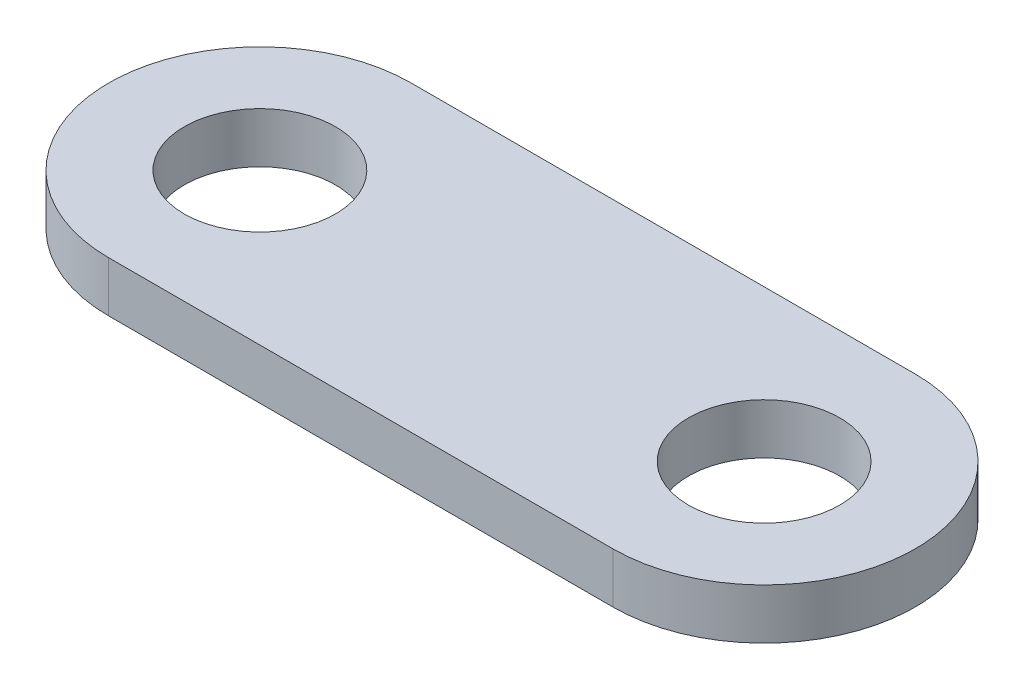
SolidWorks part; units mm, degrees
ref_plane "Front" through (0, 0, 0) normal (0, 0, 1) x (1, 0, 0)
ref_plane "Top" through (0, 0, 0) normal (0, 1, 0) x (1, 0, 0)
ref_plane "Right" through (0, 0, 0) normal (1, 0, 0) x (0, 0, -1)
sketch "Sketch1" plane through (0, 0, 0) normal (0, 1, 0) x (1, 0, 0)
  line L0 (0, 0) -> (50, 0)
  line L1 (50, 30) -> (0, 30)
  arc A0 (50, 0) -> (50, 30) centre (50, 15) ccw
  arc A1 (0, 30) -> (0, 0) centre (0, 15) ccw
  circle A2 centre (50, 15) radius 7.5
  circle A3 centre (0, 15) radius 7.5
  dimension "D2" = 15
  dimension "D3" = 15
  dimension "D1" = 50
extrude "Extrude1" add sketch "Sketch1" along normal blind 5
sketch "Sketch2" plane through (0, 5, 0) normal (0, 1, 0) x (-1, 0, 0)
  line L0 (-25, -22.5) -> (-25, -7.5) construction
  line L1 (-12.5, -22.5) -> (-37.5, -22.5)
  line L2 (-12.5, -22.5) -> (-12.5, -7.5)
  line L3 (-12.5, -7.5) -> (-37.5, -7.5)
  line L4 (-37.5, -22.5) -> (-37.5, -7.5)
  line L5 (-50, -30) -> (0, -30) construction
  line L6 (-25, -30) -> (-25, 0) construction
  line L7 (0, 0) -> (-50, 0) construction
  point P12 (-25, -15)
  dimension "D1" = 15
  dimension "D2" = 25
